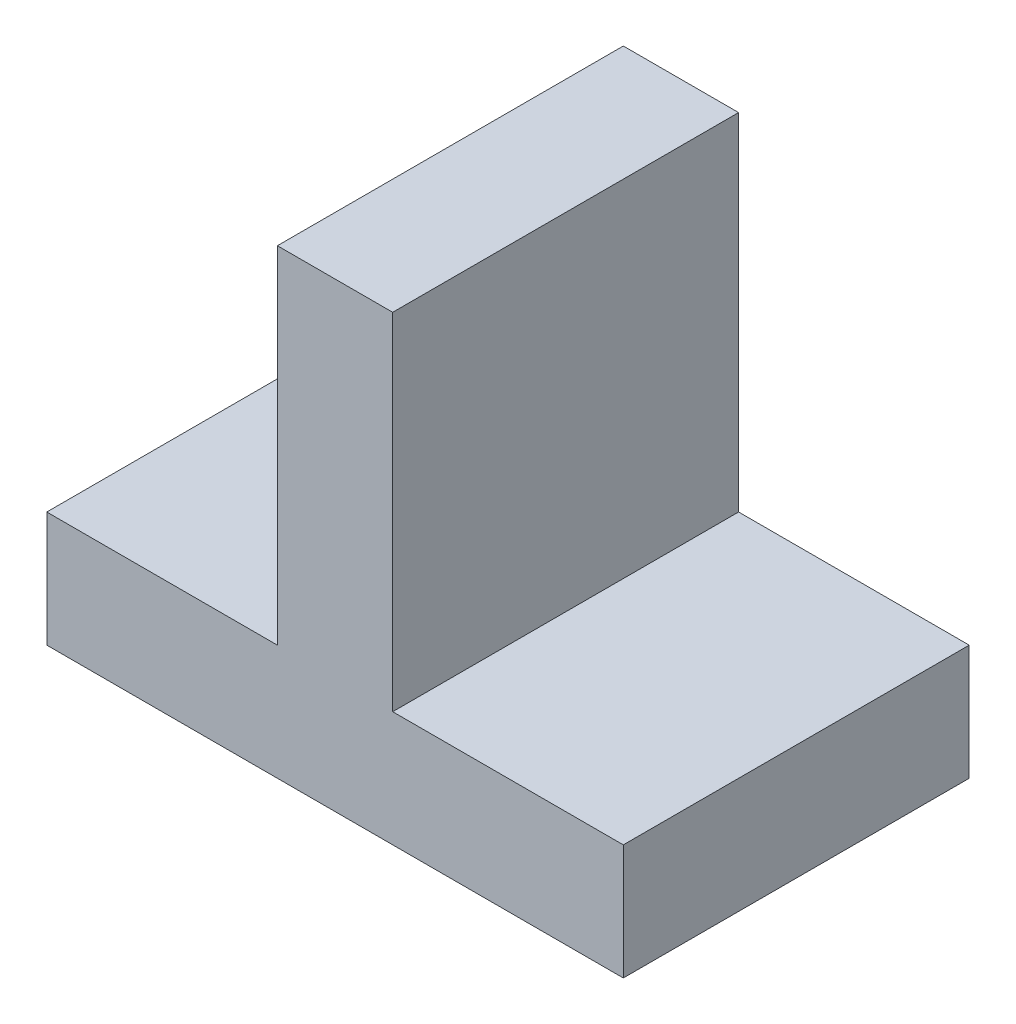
SolidWorks part; units mm, degrees
ref_plane "正面" through (0, 0, 0) normal (0, 0, 1) x (1, 0, 0)
ref_plane "平面" through (0, 0, 0) normal (0, 1, 0) x (1, 0, 0)
ref_plane "右側面" through (0, 0, 0) normal (1, 0, 0) x (0, 0, -1)
sketch "ｽｹｯﾁ1" plane through (0, 0, 0) normal (0, 1, 0) x (1, 0, 0)
  line L1 (-25, -15) -> (25, -15)
  line L2 (-25, -15) -> (-25, 15)
  line L3 (-25, 15) -> (25, 15)
  line L4 (25, -15) -> (25, 15)
  line L5 (-25, -15) -> (25, 15) construction
  line L6 (-25, 15) -> (25, -15) construction
  point P0 (0, 0)
  dimension "D1" = 50
  dimension "D2" = 30
extrude "ﾎﾞｽ - 押し出し1" add sketch "ｽｹｯﾁ1" along normal blind 10
sketch "ｽｹｯﾁ4" plane through (0, 0, 0) normal (0, 0, 1) x (1, 0, 0)
  line L0 (-25, 10) -> (25, 10) construction
  line L1 (-5, 40) -> (5, 40)
  line L2 (-5, 40) -> (-5, 10)
  line L3 (-5, 10) -> (5, 10)
  line L4 (5, 40) -> (5, 10)
  point P4 (0, 10)
  dimension "D1" = 10
  dimension "D2" = 30
extrude "ﾎﾞｽ - 押し出し2" add sketch "ｽｹｯﾁ4" along normal mid plane 30
